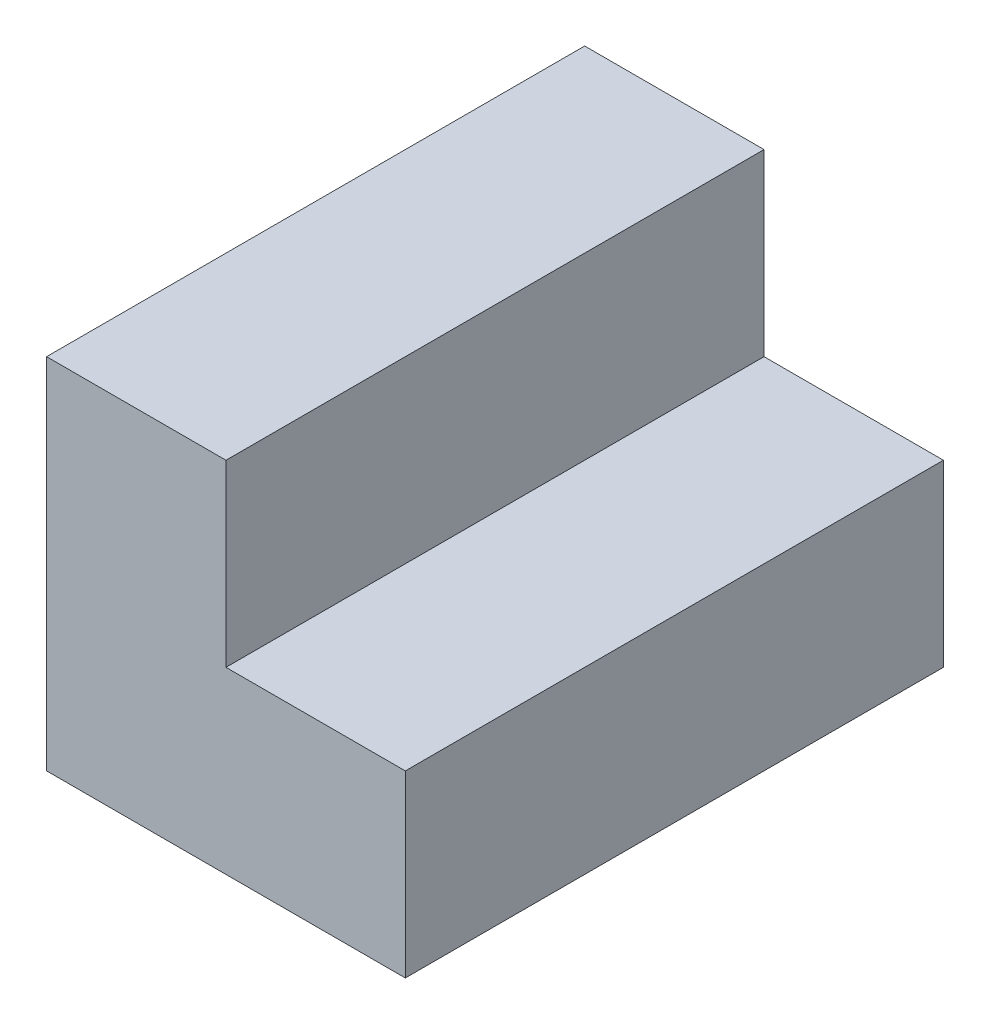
SolidWorks part; units mm, degrees
ref_plane "Front" through (0, 0, 0) normal (0, 0, 1) x (1, 0, 0)
ref_plane "Top" through (0, 0, 0) normal (0, 1, 0) x (1, 0, 0)
ref_plane "Right" through (0, 0, 0) normal (1, 0, 0) x (0, 0, -1)
sketch "Sketch1" plane through (0, 0, 0) normal (0, 0, 1) x (1, 0, 0)
  line L1 (0, 0) -> (50.8, 0)
  line L2 (0, 0) -> (0, 50.8)
  line L3 (0, 50.8) -> (50.8, 50.8)
  line L4 (50.8, 0) -> (50.8, 50.8)
  line L5 (0, 0) -> (-50.8, 0)
  line L6 (0, 0) -> (0, 101.6)
  line L7 (0, 101.6) -> (-50.8, 101.6)
  line L8 (-50.8, 0) -> (-50.8, 101.6)
  dimension "D1" = 50.8
extrude "Extrude1" add sketch "Sketch1" along normal blind 152.4 contours L8 L5 L2 L6 L7 | L1 L4 L3 L2
